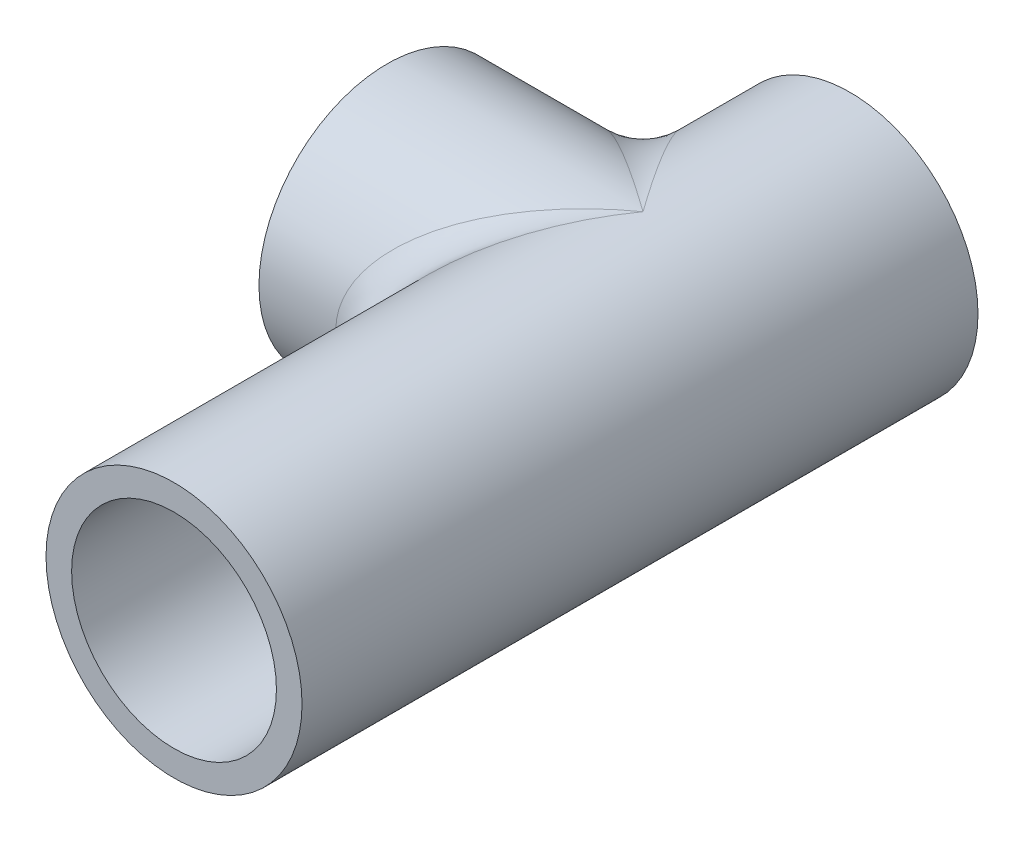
SolidWorks part; units mm, degrees
ref_plane "Front Plane" through (0, 0, 0) normal (0, 0, 1) x (1, 0, 0)
ref_plane "Top Plane" through (0, 0, 0) normal (0, 1, 0) x (1, 0, 0)
ref_plane "Right Plane" through (0, 0, 0) normal (1, 0, 0) x (0, 0, -1)
sketch "Sketch1" plane through (0, 0, 0) normal (0, 1, 0) x (1, 0, 0)
  line L0 (0, 51.4444) -> (0, -70.1407) construction
  line L2 (0, 21.4444) -> (-50, 21.4444) construction
ref_plane "Plane2" through (0, 0, 70.1407) normal (0, 0, 1) x (1, 0, 0)
sketch "Sketch3" plane through (0, 0, 70.1407) normal (0, 0, 1) x (1, 0, 0)
  circle A0 centre (0, 0) radius 25
  circle A1 centre (0, 0) radius 20
extrude "Boss-Extrude5" add sketch "Sketch3" against normal blind 130
ref_plane "Plane3" through (-50, 0, -21.4444) normal (-1, 0, 0) x (0, 0, 1)
sketch "Sketch4" plane through (-50, 0, -21.4444) normal (-1, 0, 0) x (0, 0, 1)
  circle A0 centre (0, 0) radius 20
  circle A1 centre (0, 0) radius 25
extrude "Boss-Extrude11" add sketch "Sketch4" against normal up to surface (25 mm away) contours A1 | A0
sketch "Sketch5" plane through (0, 0, -59.8593) normal (0, 0, -1) x (-1, 0, 0)
  circle A0 centre (0, 0) radius 25
extrude "Boss-Extrude12" add sketch "Sketch5" along normal blind 2
sketch "Sketch6" plane through (0, 0, -61.8593) normal (0, 0, -1) x (-1, 0, 0)
  circle A0 centre (0, 0) radius 15
extrude "Boss-Extrude13" add sketch "Sketch6" along normal blind 1
fillet "Fillet2" radius 1 1 edges at (-15, 0, -62.8593)
fillet "Fillet3" radius 10 2 edges at (-25, 0, -46.4444) (-25, 0, 3.5556)
